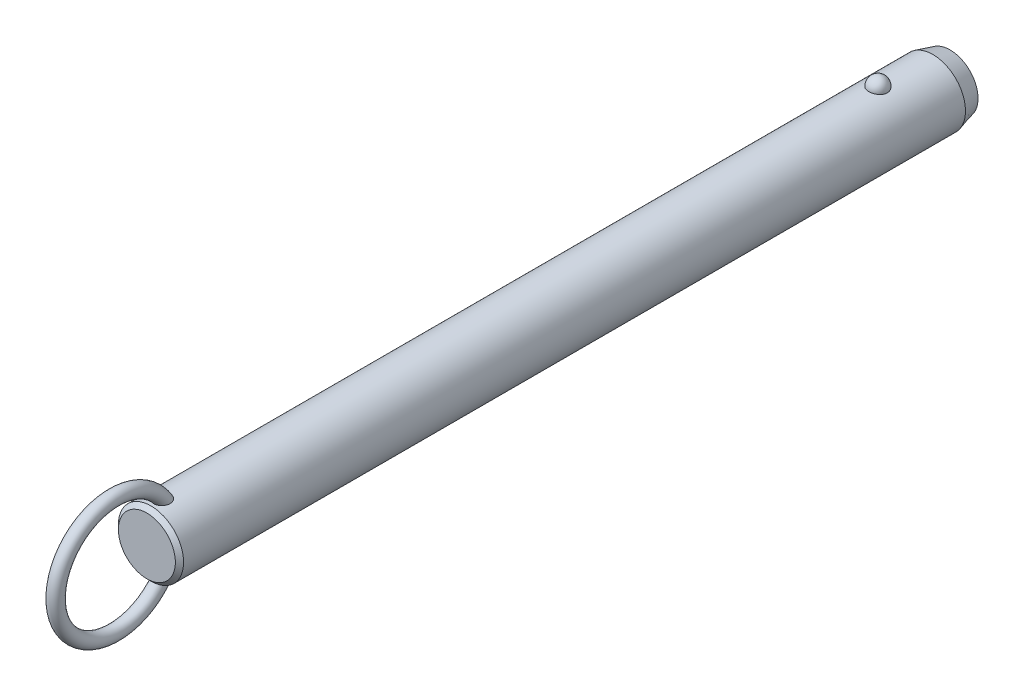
SolidWorks part; units mm, degrees
ref_plane "Front Plane" through (0, 0, 0) normal (0, 0, 1) x (1, 0, 0)
ref_plane "Top Plane" through (0, 0, 0) normal (0, 1, 0) x (1, 0, 0)
ref_plane "Right Plane" through (0, 0, 0) normal (1, 0, 0) x (0, 0, -1)
sketch "Sketch2" plane through (0, 0, 0) normal (0, 0, 1) x (1, 0, 0)
  circle A0 centre (0, 0) radius 9.5
  point P3 (0, 9.5)
  dimension "D1" = 19
extrude "Boss-Extrude1" add sketch "Sketch2" along normal blind 200.7
sketch "Sketch3" plane through (0, 0, 0) normal (0, 0, -1) x (-1, 0, 0)
  circle A0 centre (0, 0) radius 9.5
  dimension "D1" = 19
extrude "Boss-Extrude2" add sketch "Sketch3" along normal blind 23.7
chamfer "Chamfer1" distance 5 angle 15 1 edges at (-9.5, 0, -23.7)
sketch "Sketch12" plane through (0, 0, 0) normal (1, 0, 0) x (0, 0, -1)
  line L0 (-200.7, 9.5) -> (-200.7, -9.5) construction
  point P0 (-200.7, 0)
sketch "Sketch13" plane through (0, 0, 0) normal (1, 0, 0) x (0, 0, -1)
  circle A0 centre (-219.75, 0) radius 19.05
  point P2 (-200.7, 0)
  dimension "D1" = 38.1
sketch "Sketch14" plane through (0, 0, 0) normal (0, 1, 0) x (1, 0, 0)
  circle A0 centre (0, -202.7) radius 2
  point P2 (0, -200.7)
  dimension "D1" = 4
sweep "Sweep1" add profiles "Sketch14" path "Sketch13"
sketch "Sketch15" plane through (0, 0, 200.7) normal (0, 0, 1) x (1, 0, 0)
  circle A0 centre (0, 0) radius 9.5
  dimension "D1" = 19
extrude "Boss-Extrude3" add sketch "Sketch15" along normal blind 9.52
chamfer "Chamfer2" distance 1.2 angle 45 1 edges at (9.5, 0, 210.22)
sketch "Sketch18" plane through (0, 0, 0) normal (1, 0, 0) x (0, 0, -1)
  line L0 (18.7, 9.5) -> (-203.2378, 9.5) construction
  line L1 (2.7, 12.2) -> (2.7, 6.8)
  line L2 (-203.2378, -9.5) -> (18.7, -9.5) construction
  arc A0 (2.7, 12.2) -> (2.7, 6.8) centre (2.7, 9.5) ccw
  point P4 (0, 9.5)
  dimension "D1" = 21.7
revolve "Revolve1" add sketch "Sketch18" angle 360 about L1
